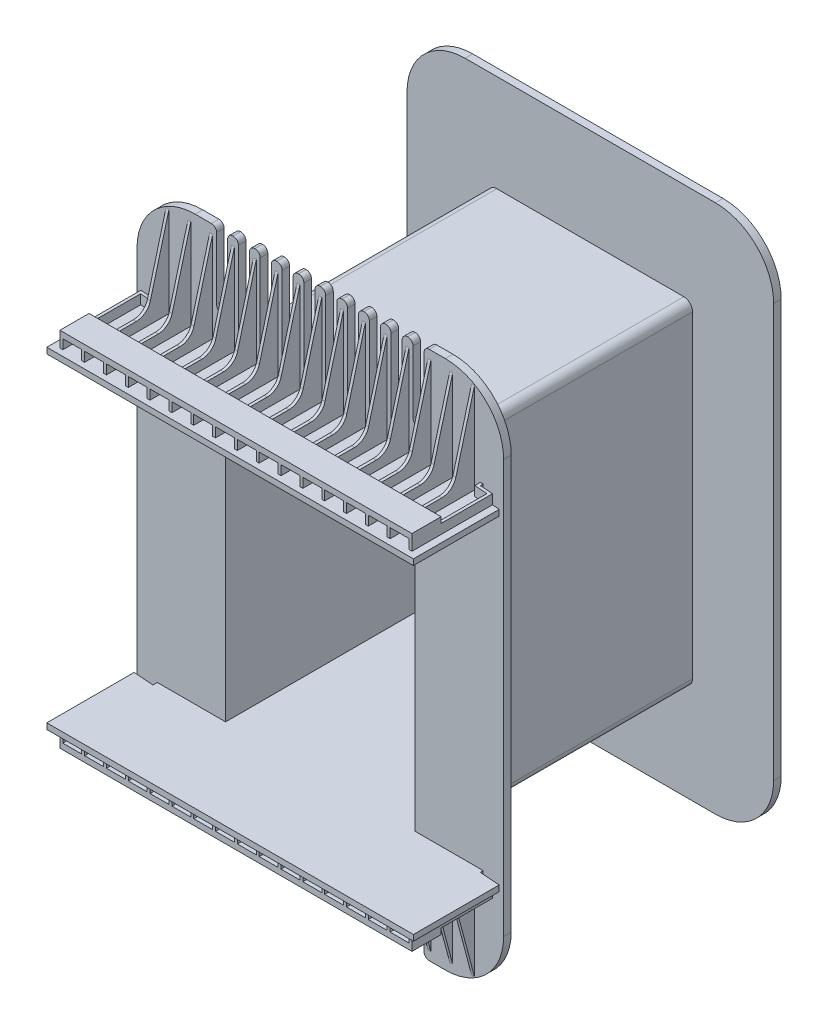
SolidWorks part; units mm, degrees
ref_plane "Vorne" through (0, 0, 0) normal (0, 0, 1) x (1, 0, 0)
ref_plane "Oben" through (0, 0, 0) normal (0, 1, 0) x (1, 0, 0)
ref_plane "Rechts" through (0, 0, 0) normal (1, 0, 0) x (0, 0, -1)
sketch "Skizze1" plane through (0, 0, 0) normal (0, 0, 1) x (1, 0, 0)
  line L1 (0, 0) -> (126, 0)
  line L2 (0, 0) -> (0, 182)
  line L3 (0, 182) -> (126, 182)
  line L4 (126, 0) -> (126, 182)
  dimension "D1" = 126
  dimension "D2" = 182
extrude "Linear austragen1" add sketch "Skizze1" along normal blind 2.6
sketch "Skizze2" plane through (0, 0, 0) normal (0, 0, -1) x (-1, 0, 0)
  line L0 (-63, 182) -> (-63, 0) construction
  line L1 (-126, 182) -> (0, 182) construction
  line L2 (0, 0) -> (-126, 0) construction
  line L4 (-119, 149.9) -> (-7, 149.9)
  line L5 (-119, 149.9) -> (-119, 146)
  line L6 (-119, 146) -> (-7, 146)
  line L7 (-7, 149.9) -> (-7, 146)
  line L8 (-119, 36) -> (-7, 36)
  line L9 (-119, 36) -> (-119, 32.1)
  line L10 (-119, 32.1) -> (-7, 32.1)
  line L11 (-7, 36) -> (-7, 32.1)
  dimension "D1" = 36
  dimension "D2" = 36
  dimension "D3" = 3.9
  dimension "D4" = 3.9
  dimension "D5" = 112
  dimension "D6" = 112
extrude "Linear austragen2" add sketch "Skizze2" along normal blind 2.9
sketch "Skizze3" plane through (0, 0, -2.9) normal (0, 0, -1) x (-1, 0, 0)
  line L0 (-7, 149.9) -> (-119, 149.9) construction
  line L1 (-102, 149.9) -> (-24, 149.9)
  line L2 (-102, 149.9) -> (-102, 146)
  line L3 (-102, 146) -> (-24, 146)
  line L4 (-24, 149.9) -> (-24, 146)
  line L5 (-119, 146) -> (-7, 146) construction
  line L6 (-7, 36) -> (-119, 36) construction
  line L7 (-102, 36) -> (-24, 36)
  line L8 (-102, 36) -> (-102, 32.1)
  line L9 (-102, 32.1) -> (-24, 32.1)
  line L10 (-24, 36) -> (-24, 32.1)
  line L11 (-119, 32.1) -> (-7, 32.1) construction
  line L12 (-63, 182) -> (-63, 0) construction
  line L13 (-126, 182) -> (0, 182) construction
  line L14 (0, 0) -> (-126, 0) construction
  dimension "D1" = 78
  dimension "D2" = 78
extrude "Linear austragen3" add sketch "Skizze3" along normal blind 3.1
sketch "Skizze4" plane through (0, 149.9, 0) normal (0, 1, 0) x (-1, 0, 0)
  line L0 (-63, -6) -> (-63, 0) construction
  line L1 (-24, -6) -> (-102, -6) construction
  line L2 (-126, 0) -> (0, 0) construction
  line L3 (-7, -2.9) -> (-24, -2.9) construction
  line L4 (-55.6, 0) -> (-52.45, 0)
  line L5 (-55.6, 0) -> (-55.6, -6)
  line L6 (-55.6, -6) -> (-52.45, -6)
  line L7 (-52.45, 0) -> (-52.45, -6)
  line L8 (-37.65, 0) -> (-34.5, 0)
  line L9 (-37.65, 0) -> (-37.65, -6)
  line L10 (-37.65, -6) -> (-34.5, -6)
  line L11 (-34.5, 0) -> (-34.5, -6)
  line L12 (-73.55, 0) -> (-70.4, 0)
  line L13 (-73.55, 0) -> (-73.55, -6)
  line L14 (-73.55, -6) -> (-70.4, -6)
  line L15 (-70.4, 0) -> (-70.4, -6)
  line L16 (-91.5, 0) -> (-88.35, 0)
  line L17 (-91.5, 0) -> (-91.5, -6)
  line L18 (-91.5, -6) -> (-88.35, -6)
  line L19 (-88.35, 0) -> (-88.35, -6)
  line L20 (-19.7, 0) -> (-16.55, 0)
  line L21 (-19.7, 0) -> (-19.7, -2.9)
  line L22 (-19.7, -2.9) -> (-16.55, -2.9)
  line L23 (-16.55, 0) -> (-16.55, -2.9)
  line L24 (-102, -2.9) -> (-119, -2.9) construction
  line L25 (-109.45, 0) -> (-106.3, 0)
  line L26 (-109.45, 0) -> (-109.45, -2.9)
  line L27 (-109.45, -2.9) -> (-106.3, -2.9)
  line L28 (-106.3, 0) -> (-106.3, -2.9)
  dimension "D1" = 3.15
  dimension "D2" = 14.8
  dimension "D3" = 14.8
  dimension "D4" = 14.8
extrude "Linear austragen4" add sketch "Skizze4" along normal offset from surface (27.8 mm away) 4.3
sketch "Skizze5" plane through (0, 32.1, 0) normal (0, -1, 0) x (1, 0, 0)
  line L0 (0, 0) -> (126, 0) construction
  line L1 (52.1, 0) -> (55.6, 0)
  line L2 (52.1, 0) -> (52.1, -6)
  line L3 (52.1, -6) -> (55.6, -6)
  line L4 (55.6, 0) -> (55.6, -6)
  line L5 (102, -6) -> (24, -6) construction
  line L6 (63, 0) -> (63, -6) construction
  line L7 (70.4, 0) -> (73.9, 0)
  line L8 (70.4, 0) -> (70.4, -6)
  line L9 (70.4, -6) -> (73.9, -6)
  line L10 (73.9, 0) -> (73.9, -6)
  line L11 (88.7, 0) -> (92.2, 0)
  line L12 (88.7, 0) -> (88.7, -6)
  line L13 (88.7, -6) -> (92.2, -6)
  line L14 (92.2, 0) -> (92.2, -6)
  line L15 (33.8, 0) -> (37.3, 0)
  line L16 (33.8, 0) -> (33.8, -6)
  line L17 (33.8, -6) -> (37.3, -6)
  line L18 (37.3, 0) -> (37.3, -6)
  line L19 (119, -2.9) -> (102, -2.9) construction
  line L20 (107, 0) -> (110.5, 0)
  line L21 (107, 0) -> (107, -2.9)
  line L22 (107, -2.9) -> (110.5, -2.9)
  line L23 (110.5, 0) -> (110.5, -2.9)
  line L24 (24, -2.9) -> (7, -2.9) construction
  line L25 (15.5, 0) -> (19, 0)
  line L26 (15.5, 0) -> (15.5, -2.9)
  line L27 (15.5, -2.9) -> (19, -2.9)
  line L28 (19, 0) -> (19, -2.9)
  dimension "D1" = 14.8
  dimension "D2" = 14.8
  dimension "D3" = 3.5
  dimension "D4" = 14.8
extrude "Linear austragen5" add sketch "Skizze5" along normal offset from surface (27.8 mm away) 4.3
sketch "Skizze6" plane through (33.8, 0, 0) normal (-1, 0, 0) x (0, 0, 1)
  line L0 (-6, 32.1) -> (0, 4.3)
  line L1 (0, 4.3) -> (-6, 4.3)
  line L2 (-6, 4.3) -> (-6, 32.1)
extrude "Schnitt-Linear austragen1" cut sketch "Skizze6" against normal up to surface (58.4 mm away)
sketch "Skizze7" plane through (15.5, 0, 0) normal (-1, 0, 0) x (0, 0, 1)
  line L0 (-2.9, 32.1) -> (0, 4.3)
  line L1 (0, 4.3) -> (-2.9, 4.3)
  line L2 (-2.9, 4.3) -> (-2.9, 32.1)
extrude "Schnitt-Linear austragen2" cut sketch "Skizze7" against normal up to next
sketch "Skizze8" plane through (110.5, 0, 0) normal (1, 0, 0) x (0, 0, -1)
  line L0 (0, 4.3) -> (2.9, 32.1)
  line L1 (2.9, 32.1) -> (2.9, 4.3)
  line L2 (0, 4.3) -> (2.9, 4.3)
extrude "Schnitt-Linear austragen3" cut sketch "Skizze8" against normal up to next
sketch "Skizze9" plane through (109.45, 0, 0) normal (1, 0, 0) x (0, 0, -1)
  line L0 (2.9, 149.9) -> (0, 177.7)
  line L1 (0, 177.7) -> (2.9, 177.7)
  line L2 (2.9, 177.7) -> (2.9, 149.9)
extrude "Schnitt-Linear austragen4" cut sketch "Skizze9" against normal up to next
sketch "Skizze10" plane through (91.5, 0, 0) normal (1, 0, 0) x (0, 0, -1)
  line L0 (0, 177.7) -> (6, 177.7)
  line L1 (6, 177.7) -> (6, 149.9)
  line L2 (6, 149.9) -> (0, 177.7)
extrude "Schnitt-Linear austragen5" cut sketch "Skizze10" against normal up to surface (57 mm away)
sketch "Skizze11" plane through (16.55, 0, 0) normal (-1, 0, 0) x (0, 0, 1)
  line L0 (-2.9, 149.9) -> (-2.9, 177.7)
  line L1 (-2.9, 177.7) -> (0, 177.7)
  line L2 (0, 177.7) -> (-2.9, 149.9)
extrude "Schnitt-Linear austragen6" cut sketch "Skizze11" against normal up to next
sketch "Skizze12" plane through (0, 0, 2.6) normal (0, 0, 1) x (1, 0, 0)
  line L0 (63, 182) -> (63, 0) construction
  line L1 (126, 182) -> (0, 182) construction
  line L2 (0, 0) -> (126, 0) construction
  line L4 (27.85, 148.6) -> (98.15, 148.6)
  line L5 (27.85, 148.6) -> (27.85, 33.4)
  line L6 (27.85, 33.4) -> (98.15, 33.4)
  line L7 (98.15, 148.6) -> (98.15, 33.4)
  dimension "D1" = 33.4
  dimension "D2" = 33.4
  dimension "D3" = 70.3
extrude "Linear austragen6" add sketch "Skizze12" along normal blind 90.2
sketch "Skizze13" plane through (0, 0, 92.8) normal (0, 0, 1) x (1, 0, 0)
  line L0 (0, 0) -> (126, 0) construction
  line L1 (0, 182) -> (126, 182)
  line L2 (0, 182) -> (0, 0)
  line L3 (0, 0) -> (126, 0)
  line L4 (126, 182) -> (126, 0)
  line L5 (126, 182) -> (0, 182) construction
  line L8 (0, 182) -> (0, 0) construction
  line L9 (126, 0) -> (126, 182) construction
extrude "Linear austragen7" add sketch "Skizze13" along normal blind 2.6
sketch "Skizze14" plane through (0, 0, 95.4) normal (0, 0, 1) x (1, 0, 0)
  line L0 (63, 182) -> (63, 0) construction
  line L1 (126, 182) -> (0, 182) construction
  line L2 (0, 0) -> (126, 0) construction
  line L3 (126, 91) -> (0, 91) construction
  line L4 (126, 0) -> (126, 182) construction
  line L5 (0, 182) -> (0, 0) construction
  line L7 (30.45, 145.9) -> (95.55, 145.9)
  line L8 (30.45, 145.9) -> (30.45, 36.1)
  line L9 (30.45, 36.1) -> (95.55, 36.1)
  line L10 (95.55, 145.9) -> (95.55, 36.1)
  dimension "D1" = 36.1
  dimension "D2" = 36.1
  dimension "D3" = 65.1
extrude "Schnitt-Linear austragen7" cut sketch "Skizze14" against normal through all
sketch "Skizze15" plane through (0, 0, 95.4) normal (0, 0, 1) x (1, 0, 0)
  line L0 (30.45, 36.1) -> (95.55, 36.1) construction
  line L1 (0, 147.9) -> (126, 147.9)
  line L2 (0, 147.9) -> (0, 145.9)
  line L3 (0, 145.9) -> (126, 145.9)
  line L4 (126, 147.9) -> (126, 145.9)
  line L5 (0, 36.1) -> (126, 36.1)
  line L6 (0, 36.1) -> (0, 34.1)
  line L7 (0, 34.1) -> (126, 34.1)
  line L8 (126, 36.1) -> (126, 34.1)
  line L9 (95.55, 145.9) -> (30.45, 145.9) construction
  line L10 (126, 0) -> (126, 182) construction
  line L11 (0, 182) -> (0, 0) construction
  dimension "D1" = 2
  dimension "D2" = 2
extrude "Linear austragen8" add sketch "Skizze15" along normal blind 31
sketch "Skizze16" plane through (0, 147.9, 0) normal (0, 1, 0) x (-1, 0, 0)
  line L0 (-126, 126.4) -> (0, 126.4) construction
  line L3 (-3.5, 124.4) -> (-2.5, 124.4)
  line L4 (-3.5, 124.4) -> (-3.5, 95.4)
  line L5 (-3.5, 95.4) -> (-2.5, 95.4)
  line L6 (-2.5, 124.4) -> (-2.5, 95.4)
  line L7 (-126, 95.4) -> (0, 95.4) construction
  line L8 (-63, 126.4) -> (-63, 95.4) construction
  line L9 (-11, 124.4) -> (-11, 95.4)
  line L10 (-10, 124.4) -> (-10, 95.4)
  line L11 (-11, 124.4) -> (-10, 124.4)
  line L12 (-11, 95.4) -> (-10, 95.4)
  line L13 (-18.5, 124.4) -> (-18.5, 95.4)
  line L14 (-17.5, 124.4) -> (-17.5, 95.4)
  line L15 (-18.5, 124.4) -> (-17.5, 124.4)
  line L16 (-18.5, 95.4) -> (-17.5, 95.4)
  line L17 (-26, 124.4) -> (-26, 95.4)
  line L18 (-25, 124.4) -> (-25, 95.4)
  line L19 (-26, 124.4) -> (-25, 124.4)
  line L20 (-26, 95.4) -> (-25, 95.4)
  line L21 (-33.5, 124.4) -> (-33.5, 95.4)
  line L22 (-32.5, 124.4) -> (-32.5, 95.4)
  line L23 (-33.5, 124.4) -> (-32.5, 124.4)
  line L24 (-33.5, 95.4) -> (-32.5, 95.4)
  line L25 (-41, 124.4) -> (-41, 95.4)
  line L26 (-40, 124.4) -> (-40, 95.4)
  line L27 (-41, 124.4) -> (-40, 124.4)
  line L28 (-41, 95.4) -> (-40, 95.4)
  line L29 (-48.5, 124.4) -> (-48.5, 95.4)
  line L30 (-47.5, 124.4) -> (-47.5, 95.4)
  line L31 (-48.5, 124.4) -> (-47.5, 124.4)
  line L32 (-48.5, 95.4) -> (-47.5, 95.4)
  line L33 (-56, 124.4) -> (-56, 95.4)
  line L34 (-55, 124.4) -> (-55, 95.4)
  line L35 (-56, 124.4) -> (-55, 124.4)
  line L36 (-56, 95.4) -> (-55, 95.4)
  line L37 (-63.5, 124.4) -> (-63.5, 95.4)
  line L38 (-62.5, 124.4) -> (-62.5, 95.4)
  line L39 (-63.5, 124.4) -> (-62.5, 124.4)
  line L40 (-63.5, 95.4) -> (-62.5, 95.4)
  line L41 (-71, 124.4) -> (-71, 95.4)
  line L42 (-70, 124.4) -> (-70, 95.4)
  line L43 (-71, 124.4) -> (-70, 124.4)
  line L44 (-71, 95.4) -> (-70, 95.4)
  line L45 (-78.5, 124.4) -> (-78.5, 95.4)
  line L46 (-77.5, 124.4) -> (-77.5, 95.4)
  line L47 (-78.5, 124.4) -> (-77.5, 124.4)
  line L48 (-78.5, 95.4) -> (-77.5, 95.4)
  line L49 (-86, 124.4) -> (-86, 95.4)
  line L50 (-85, 124.4) -> (-85, 95.4)
  line L51 (-86, 124.4) -> (-85, 124.4)
  line L52 (-86, 95.4) -> (-85, 95.4)
  line L53 (-93.5, 124.4) -> (-93.5, 95.4)
  line L54 (-92.5, 124.4) -> (-92.5, 95.4)
  line L55 (-93.5, 124.4) -> (-92.5, 124.4)
  line L56 (-93.5, 95.4) -> (-92.5, 95.4)
  line L57 (-101, 124.4) -> (-101, 95.4)
  line L58 (-100, 124.4) -> (-100, 95.4)
  line L59 (-101, 124.4) -> (-100, 124.4)
  line L60 (-101, 95.4) -> (-100, 95.4)
  line L61 (-108.5, 124.4) -> (-108.5, 95.4)
  line L62 (-107.5, 124.4) -> (-107.5, 95.4)
  line L63 (-108.5, 124.4) -> (-107.5, 124.4)
  line L64 (-108.5, 95.4) -> (-107.5, 95.4)
  line L65 (-116, 124.4) -> (-116, 95.4)
  line L66 (-115, 124.4) -> (-115, 95.4)
  line L67 (-116, 124.4) -> (-115, 124.4)
  line L68 (-116, 95.4) -> (-115, 95.4)
  line L69 (-123.5, 124.4) -> (-123.5, 95.4)
  line L70 (-122.5, 124.4) -> (-122.5, 95.4)
  line L71 (-123.5, 124.4) -> (-122.5, 124.4)
  line L72 (-123.5, 95.4) -> (-122.5, 95.4)
  dimension "D1" = 1
  dimension "D2" = 60.5
  dimension "D3" = 60.5
  dimension "D4" = 6.5
  dimension "D5" = 6.5
  dimension "D6" = 6.5
  dimension "D7" = 6.5
  dimension "D8" = 6.5
  dimension "D9" = 6.5
  dimension "D10" = 6.5
  dimension "D11" = 6.5
  dimension "D12" = 2
extrude "Linear austragen9" add sketch "Skizze16" along normal blind 3.3
sketch "Skizze18" plane through (0, 34.1, 0) normal (0, -1, 0) x (1, 0, 0)
  line L0 (63, 95.4) -> (63, 126.4) construction
  line L1 (0, 95.4) -> (126, 95.4) construction
  line L2 (0, 126.4) -> (126, 126.4) construction
  line L3 (116, 95.4) -> (116, 124.4)
  line L4 (123.5, 95.4) -> (122.5, 95.4)
  line L5 (123.5, 95.4) -> (123.5, 124.4)
  line L6 (123.5, 124.4) -> (122.5, 124.4)
  line L7 (122.5, 95.4) -> (122.5, 124.4)
  line L8 (116, 95.4) -> (115, 95.4)
  line L9 (116, 124.4) -> (115, 124.4)
  line L10 (115, 95.4) -> (115, 124.4)
  line L11 (108.5, 95.4) -> (108.5, 124.4)
  line L12 (108.5, 95.4) -> (107.5, 95.4)
  line L13 (108.5, 124.4) -> (107.5, 124.4)
  line L14 (107.5, 95.4) -> (107.5, 124.4)
  line L15 (101, 95.4) -> (101, 124.4)
  line L16 (101, 95.4) -> (100, 95.4)
  line L17 (101, 124.4) -> (100, 124.4)
  line L18 (100, 95.4) -> (100, 124.4)
  line L19 (93.5, 95.4) -> (93.5, 124.4)
  line L20 (93.5, 95.4) -> (92.5, 95.4)
  line L21 (93.5, 124.4) -> (92.5, 124.4)
  line L22 (92.5, 95.4) -> (92.5, 124.4)
  line L23 (86, 95.4) -> (86, 124.4)
  line L24 (86, 95.4) -> (85, 95.4)
  line L25 (86, 124.4) -> (85, 124.4)
  line L26 (85, 95.4) -> (85, 124.4)
  line L27 (78.5, 95.4) -> (78.5, 124.4)
  line L28 (78.5, 95.4) -> (77.5, 95.4)
  line L29 (78.5, 124.4) -> (77.5, 124.4)
  line L30 (77.5, 95.4) -> (77.5, 124.4)
  line L31 (71, 95.4) -> (71, 124.4)
  line L32 (71, 95.4) -> (70, 95.4)
  line L33 (71, 124.4) -> (70, 124.4)
  line L34 (70, 95.4) -> (70, 124.4)
  line L35 (63.5, 95.4) -> (63.5, 124.4)
  line L36 (63.5, 95.4) -> (62.5, 95.4)
  line L37 (63.5, 124.4) -> (62.5, 124.4)
  line L38 (62.5, 95.4) -> (62.5, 124.4)
  line L39 (56, 95.4) -> (56, 124.4)
  line L40 (56, 95.4) -> (55, 95.4)
  line L41 (56, 124.4) -> (55, 124.4)
  line L42 (55, 95.4) -> (55, 124.4)
  line L43 (48.5, 95.4) -> (48.5, 124.4)
  line L44 (48.5, 95.4) -> (47.5, 95.4)
  line L45 (48.5, 124.4) -> (47.5, 124.4)
  line L46 (47.5, 95.4) -> (47.5, 124.4)
  line L47 (41, 95.4) -> (41, 124.4)
  line L48 (41, 95.4) -> (40, 95.4)
  line L49 (41, 124.4) -> (40, 124.4)
  line L50 (40, 95.4) -> (40, 124.4)
  line L51 (33.5, 95.4) -> (33.5, 124.4)
  line L52 (33.5, 95.4) -> (32.5, 95.4)
  line L53 (33.5, 124.4) -> (32.5, 124.4)
  line L54 (32.5, 95.4) -> (32.5, 124.4)
  line L55 (26, 95.4) -> (26, 124.4)
  line L56 (26, 95.4) -> (25, 95.4)
  line L57 (26, 124.4) -> (25, 124.4)
  line L58 (25, 95.4) -> (25, 124.4)
  line L59 (18.5, 95.4) -> (18.5, 124.4)
  line L60 (18.5, 95.4) -> (17.5, 95.4)
  line L61 (18.5, 124.4) -> (17.5, 124.4)
  line L62 (17.5, 95.4) -> (17.5, 124.4)
  line L63 (11, 95.4) -> (11, 124.4)
  line L64 (11, 95.4) -> (10, 95.4)
  line L65 (11, 124.4) -> (10, 124.4)
  line L66 (10, 95.4) -> (10, 124.4)
  line L67 (3.5, 95.4) -> (3.5, 124.4)
  line L68 (3.5, 95.4) -> (2.5, 95.4)
  line L69 (3.5, 124.4) -> (2.5, 124.4)
  line L70 (2.5, 95.4) -> (2.5, 124.4)
  dimension "D1" = 2
  dimension "D2" = 1
  dimension "D3" = 60.5
  dimension "D4" = 6.5
  dimension "D5" = 6.5
  dimension "D6" = 6.5
  dimension "D7" = 6.5
  dimension "D8" = 6.5
  dimension "D9" = 6.5
  dimension "D10" = 6.5
  dimension "D11" = 6.5
  dimension "D12" = 6.5
  dimension "D13" = 6.5
  dimension "D14" = 6.5
  dimension "D15" = 6.5
  dimension "D16" = 6.5
  dimension "D17" = 6.5
  dimension "D18" = 6.5
  dimension "D19" = 6.5
extrude "Linear austragen10" add sketch "Skizze18" along normal blind 3.3
sketch "Skizze19" plane through (0, 30.8, 0) normal (0, -1, 0) x (1, 0, 0)
  line L0 (123.5, 95.4) -> (123.5, 124.4) construction
  line L1 (2.5, 124.4) -> (123.5, 124.4)
  line L2 (2.5, 124.4) -> (2.5, 114.4)
  line L3 (2.5, 114.4) -> (123.5, 114.4)
  line L4 (123.5, 124.4) -> (123.5, 114.4)
  dimension "D1" = 10
extrude "Linear austragen11" add sketch "Skizze19" along normal blind 2
sketch "Skizze20" plane through (0, 151.2, 0) normal (0, 1, 0) x (-1, 0, 0)
  line L0 (-2.5, 95.4) -> (-2.5, 124.4) construction
  line L1 (-123.5, 124.4) -> (-2.5, 124.4)
  line L2 (-123.5, 124.4) -> (-123.5, 114.4)
  line L3 (-123.5, 114.4) -> (-2.5, 114.4)
  line L4 (-2.5, 124.4) -> (-2.5, 114.4)
  dimension "D1" = 10
extrude "Linear austragen12" add sketch "Skizze20" along normal blind 2
sketch "Skizze21" plane through (0, 151.2, 0) normal (0, 1, 0) x (-1, 0, 0)
  line L0 (-115, 95.4) -> (-115, 114.4) construction
  line L1 (-116, 95.4) -> (-115, 95.4)
  line L2 (-116, 95.4) -> (-116, 102.8)
  line L3 (-116, 102.8) -> (-115, 102.8)
  line L4 (-115, 95.4) -> (-115, 102.8)
  line L5 (-107.5, 95.4) -> (-107.5, 114.4) construction
  line L6 (-108.5, 95.4) -> (-107.5, 95.4)
  line L7 (-108.5, 95.4) -> (-108.5, 102.8)
  line L8 (-108.5, 102.8) -> (-107.5, 102.8)
  line L9 (-107.5, 95.4) -> (-107.5, 102.8)
  line L10 (-100, 95.4) -> (-100, 114.4) construction
  line L11 (-101, 95.4) -> (-100, 95.4)
  line L12 (-101, 95.4) -> (-101, 102.8)
  line L13 (-101, 102.8) -> (-100, 102.8)
  line L14 (-100, 95.4) -> (-100, 102.8)
  line L15 (-92.5, 95.4) -> (-92.5, 114.4) construction
  line L16 (-93.5, 95.4) -> (-92.5, 95.4)
  line L17 (-93.5, 95.4) -> (-93.5, 102.8)
  line L18 (-93.5, 102.8) -> (-92.5, 102.8)
  line L19 (-92.5, 95.4) -> (-92.5, 102.8)
  line L20 (-85, 95.4) -> (-85, 114.4) construction
  line L21 (-86, 95.4) -> (-85, 95.4)
  line L22 (-86, 95.4) -> (-86, 102.8)
  line L23 (-86, 102.8) -> (-85, 102.8)
  line L24 (-85, 95.4) -> (-85, 102.8)
  line L25 (-77.5, 95.4) -> (-77.5, 114.4) construction
  line L26 (-78.5, 95.4) -> (-77.5, 95.4)
  line L27 (-78.5, 95.4) -> (-78.5, 102.8)
  line L28 (-78.5, 102.8) -> (-77.5, 102.8)
  line L29 (-77.5, 95.4) -> (-77.5, 102.8)
  line L30 (-70, 95.4) -> (-70, 114.4) construction
  line L31 (-71, 95.4) -> (-70, 95.4)
  line L32 (-71, 95.4) -> (-71, 102.8)
  line L33 (-71, 102.8) -> (-70, 102.8)
  line L34 (-70, 95.4) -> (-70, 102.8)
  line L35 (-62.5, 95.4) -> (-62.5, 114.4) construction
  line L36 (-63.5, 95.4) -> (-62.5, 95.4)
  line L37 (-63.5, 95.4) -> (-63.5, 102.8)
  line L38 (-63.5, 102.8) -> (-62.5, 102.8)
  line L39 (-62.5, 95.4) -> (-62.5, 102.8)
  line L40 (-55, 95.4) -> (-55, 114.4) construction
  line L41 (-56, 95.4) -> (-55, 95.4)
  line L42 (-56, 95.4) -> (-56, 102.8)
  line L43 (-56, 102.8) -> (-55, 102.8)
  line L44 (-55, 95.4) -> (-55, 102.8)
  line L45 (-47.5, 95.4) -> (-47.5, 114.4) construction
  line L46 (-48.5, 95.4) -> (-47.5, 95.4)
  line L47 (-48.5, 95.4) -> (-48.5, 102.8)
  line L48 (-48.5, 102.8) -> (-47.5, 102.8)
  line L49 (-47.5, 95.4) -> (-47.5, 102.8)
  line L50 (-40, 95.4) -> (-40, 114.4) construction
  line L51 (-41, 95.4) -> (-40, 95.4)
  line L52 (-41, 95.4) -> (-41, 102.8)
  line L53 (-41, 102.8) -> (-40, 102.8)
  line L54 (-40, 95.4) -> (-40, 102.8)
  line L55 (-32.5, 95.4) -> (-32.5, 114.4) construction
  line L56 (-33.5, 95.4) -> (-32.5, 95.4)
  line L57 (-33.5, 95.4) -> (-33.5, 102.8)
  line L58 (-33.5, 102.8) -> (-32.5, 102.8)
  line L59 (-32.5, 95.4) -> (-32.5, 102.8)
  line L60 (-25, 95.4) -> (-25, 114.4) construction
  line L61 (-26, 95.4) -> (-25, 95.4)
  line L62 (-26, 95.4) -> (-26, 102.8)
  line L63 (-26, 102.8) -> (-25, 102.8)
  line L64 (-25, 95.4) -> (-25, 102.8)
  line L65 (-17.5, 95.4) -> (-17.5, 114.4) construction
  line L66 (-18.5, 95.4) -> (-17.5, 95.4)
  line L67 (-18.5, 95.4) -> (-18.5, 102.8)
  line L68 (-18.5, 102.8) -> (-17.5, 102.8)
  line L69 (-17.5, 95.4) -> (-17.5, 102.8)
  line L70 (-10, 95.4) -> (-10, 114.4) construction
  line L71 (-11, 95.4) -> (-10, 95.4)
  line L72 (-11, 95.4) -> (-11, 102.8)
  line L73 (-11, 102.8) -> (-10, 102.8)
  line L74 (-10, 95.4) -> (-10, 102.8)
  line L75 (-126, 92.8) -> (0, 92.8) construction
  dimension "D1" = 10
extrude "Linear austragen13" add sketch "Skizze21" along normal offset from surface (27.8 mm away) 3
sketch "Skizze22" plane through (10, 0, 0) normal (-1, 0, 0) x (0, 0, 1)
  line L0 (102.8, 151.2) -> (95.4, 179)
  line L1 (95.4, 179) -> (102.8, 179)
  line L2 (102.8, 179) -> (102.8, 151.2)
extrude "Schnitt-Linear austragen8" cut sketch "Skizze22" against normal through all
sketch "Skizze23" plane through (0, 30.8, 0) normal (0, -1, 0) x (1, 0, 0)
  line L0 (10, 114.4) -> (10, 95.4) construction
  line L1 (11, 95.4) -> (10, 95.4)
  line L2 (11, 95.4) -> (11, 102.8)
  line L3 (11, 102.8) -> (10, 102.8)
  line L4 (10, 95.4) -> (10, 102.8)
  line L5 (17.5, 114.4) -> (17.5, 95.4) construction
  line L6 (18.5, 95.4) -> (17.5, 95.4)
  line L7 (18.5, 95.4) -> (18.5, 102.8)
  line L8 (18.5, 102.8) -> (17.5, 102.8)
  line L9 (17.5, 95.4) -> (17.5, 102.8)
  line L10 (25, 114.4) -> (25, 95.4) construction
  line L11 (26, 95.4) -> (25, 95.4)
  line L12 (26, 95.4) -> (26, 102.8)
  line L13 (26, 102.8) -> (25, 102.8)
  line L14 (25, 95.4) -> (25, 102.8)
  line L15 (32.5, 114.4) -> (32.5, 95.4) construction
  line L16 (33.5, 95.4) -> (32.5, 95.4)
  line L17 (33.5, 95.4) -> (33.5, 102.8)
  line L18 (33.5, 102.8) -> (32.5, 102.8)
  line L19 (32.5, 95.4) -> (32.5, 102.8)
  line L20 (40, 114.4) -> (40, 95.4) construction
  line L21 (41, 95.4) -> (40, 95.4)
  line L22 (41, 95.4) -> (41, 102.8)
  line L23 (41, 102.8) -> (40, 102.8)
  line L24 (40, 95.4) -> (40, 102.8)
  line L25 (47.5, 114.4) -> (47.5, 95.4) construction
  line L26 (48.5, 95.4) -> (47.5, 95.4)
  line L27 (48.5, 95.4) -> (48.5, 102.8)
  line L28 (48.5, 102.8) -> (47.5, 102.8)
  line L29 (47.5, 95.4) -> (47.5, 102.8)
  line L30 (55, 114.4) -> (55, 95.4) construction
  line L31 (56, 95.4) -> (55, 95.4)
  line L32 (56, 95.4) -> (56, 102.8)
  line L33 (56, 102.8) -> (55, 102.8)
  line L34 (55, 95.4) -> (55, 102.8)
  line L35 (62.5, 114.4) -> (62.5, 95.4) construction
  line L36 (63.5, 95.4) -> (62.5, 95.4)
  line L37 (63.5, 95.4) -> (63.5, 102.8)
  line L38 (63.5, 102.8) -> (62.5, 102.8)
  line L39 (62.5, 95.4) -> (62.5, 102.8)
  line L40 (70, 114.4) -> (70, 95.4) construction
  line L41 (71, 95.4) -> (70, 95.4)
  line L42 (71, 95.4) -> (71, 102.8)
  line L43 (71, 102.8) -> (70, 102.8)
  line L44 (70, 95.4) -> (70, 102.8)
  line L45 (77.5, 114.4) -> (77.5, 95.4) construction
  line L46 (78.5, 95.4) -> (77.5, 95.4)
  line L47 (78.5, 95.4) -> (78.5, 102.8)
  line L48 (78.5, 102.8) -> (77.5, 102.8)
  line L49 (77.5, 95.4) -> (77.5, 102.8)
  line L50 (85, 114.4) -> (85, 95.4) construction
  line L51 (86, 95.4) -> (85, 95.4)
  line L52 (86, 95.4) -> (86, 102.8)
  line L53 (86, 102.8) -> (85, 102.8)
  line L54 (85, 95.4) -> (85, 102.8)
  line L55 (92.5, 114.4) -> (92.5, 95.4) construction
  line L56 (93.5, 95.4) -> (92.5, 95.4)
  line L57 (93.5, 95.4) -> (93.5, 102.8)
  line L58 (93.5, 102.8) -> (92.5, 102.8)
  line L59 (92.5, 95.4) -> (92.5, 102.8)
  line L60 (100, 114.4) -> (100, 95.4) construction
  line L61 (101, 95.4) -> (100, 95.4)
  line L62 (101, 95.4) -> (101, 102.8)
  line L63 (101, 102.8) -> (100, 102.8)
  line L64 (100, 95.4) -> (100, 102.8)
  line L65 (107.5, 114.4) -> (107.5, 95.4) construction
  line L66 (108.5, 95.4) -> (107.5, 95.4)
  line L67 (108.5, 95.4) -> (108.5, 102.8)
  line L68 (108.5, 102.8) -> (107.5, 102.8)
  line L69 (107.5, 95.4) -> (107.5, 102.8)
  line L70 (115, 114.4) -> (115, 95.4) construction
  line L71 (116, 95.4) -> (115, 95.4)
  line L72 (116, 95.4) -> (116, 102.8)
  line L73 (116, 102.8) -> (115, 102.8)
  line L74 (115, 95.4) -> (115, 102.8)
  line L75 (0, 92.8) -> (126, 92.8) construction
  dimension "D1" = 10
extrude "Linear austragen14" add sketch "Skizze23" along normal offset from surface (27.8 mm away) 3
sketch "Skizze24" plane through (10, 0, 0) normal (-1, 0, 0) x (0, 0, 1)
  line L0 (102.8, 30.8) -> (95.4, 3)
  line L1 (95.4, 3) -> (102.8, 3)
  line L2 (102.8, 3) -> (102.8, 30.8)
extrude "Schnitt-Linear austragen9" cut sketch "Skizze24" against normal through all
sketch "Skizze25" plane through (0, 0, 95.4) normal (0, 0, 1) x (1, 0, 0)
  line L0 (63, 182) -> (63, 145.9) construction
  line L1 (126, 182) -> (0, 182) construction
  line L2 (0, 145.9) -> (126, 145.9) construction
  line L4 (57.35, 182) -> (61.15, 182)
  line L5 (57.35, 182) -> (57.35, 151)
  line L6 (57.35, 151) -> (61.15, 151)
  line L7 (61.15, 182) -> (61.15, 151)
  line L8 (64.85, 182) -> (68.65, 182)
  line L9 (64.85, 182) -> (64.85, 151)
  line L10 (64.85, 151) -> (68.65, 151)
  line L11 (68.65, 182) -> (68.65, 151)
  line L12 (72.35, 182) -> (76.15, 182)
  line L13 (72.35, 182) -> (72.35, 151)
  line L14 (72.35, 151) -> (76.15, 151)
  line L15 (76.15, 182) -> (76.15, 151)
  line L16 (79.85, 182) -> (83.65, 182)
  line L17 (79.85, 182) -> (79.85, 151)
  line L18 (79.85, 151) -> (83.65, 151)
  line L19 (83.65, 182) -> (83.65, 151)
  line L20 (87.35, 182) -> (91.15, 182)
  line L21 (87.35, 182) -> (87.35, 148.6)
  line L22 (87.35, 148.6) -> (91.15, 148.6)
  line L23 (91.15, 182) -> (91.15, 148.6)
  line L24 (94.85, 182) -> (98.65, 182)
  line L25 (94.85, 182) -> (94.85, 157)
  line L26 (94.85, 157) -> (98.65, 157)
  line L27 (98.65, 182) -> (98.65, 157)
  line L30 (98.15, 148.6) -> (27.85, 148.6) construction
  line L36 (49.85, 182) -> (53.65, 182)
  line L37 (49.85, 182) -> (49.85, 151)
  line L38 (49.85, 151) -> (53.65, 151)
  line L39 (53.65, 182) -> (53.65, 151)
  line L40 (42.35, 182) -> (46.15, 182)
  line L41 (42.35, 182) -> (42.35, 151)
  line L42 (42.35, 151) -> (46.15, 151)
  line L43 (46.15, 182) -> (46.15, 151)
  line L44 (34.85, 182) -> (38.65, 182)
  line L45 (34.85, 182) -> (34.85, 148.6)
  line L46 (34.85, 148.6) -> (38.65, 148.6)
  line L47 (38.65, 182) -> (38.65, 148.6)
  line L48 (27.35, 182) -> (31.15, 182)
  line L49 (27.35, 182) -> (27.35, 157)
  line L50 (27.35, 157) -> (31.15, 157)
  line L51 (31.15, 182) -> (31.15, 157)
  dimension "D2" = 25
  dimension "D3" = 31
  dimension "D4" = 3.7
  dimension "D5" = 3.7
  dimension "D6" = 3.7
  dimension "D7" = 3.7
  dimension "D8" = 3.7
  dimension "D9" = 3.8
  dimension "D10" = 25
extrude "Schnitt-Linear austragen10" cut sketch "Skizze25" against normal up to surface (2.6 mm away)
sketch "Skizze26" plane through (0, 0, 95.4) normal (0, 0, 1) x (1, 0, 0)
  line L0 (0, 0) -> (126, 0) construction
  line L1 (27.35, 0) -> (31.15, 0)
  line L2 (27.35, 0) -> (27.35, 25)
  line L3 (27.35, 25) -> (31.15, 25)
  line L4 (31.15, 0) -> (31.15, 25)
  line L5 (63, 0) -> (63, 145.9) construction
  line L6 (34.85, 0) -> (38.65, 0)
  line L7 (34.85, 0) -> (34.85, 33.4)
  line L8 (34.85, 33.4) -> (38.65, 33.4)
  line L9 (38.65, 0) -> (38.65, 33.4)
  line L10 (42.35, 0) -> (46.15, 0)
  line L11 (42.35, 0) -> (42.35, 31)
  line L12 (42.35, 31) -> (46.15, 31)
  line L13 (46.15, 0) -> (46.15, 31)
  line L14 (49.85, 0) -> (53.65, 0)
  line L15 (49.85, 0) -> (49.85, 31)
  line L16 (49.85, 31) -> (53.65, 31)
  line L17 (53.65, 0) -> (53.65, 31)
  line L18 (57.35, 0) -> (61.15, 0)
  line L19 (57.35, 0) -> (57.35, 31)
  line L20 (57.35, 31) -> (61.15, 31)
  line L21 (61.15, 0) -> (61.15, 31)
  line L22 (64.85, 0) -> (68.65, 0)
  line L23 (64.85, 0) -> (64.85, 31)
  line L24 (64.85, 31) -> (68.65, 31)
  line L25 (68.65, 0) -> (68.65, 31)
  line L26 (72.35, 0) -> (76.15, 0)
  line L27 (72.35, 0) -> (72.35, 31)
  line L28 (72.35, 31) -> (76.15, 31)
  line L29 (76.15, 0) -> (76.15, 31)
  line L30 (79.85, 0) -> (83.65, 0)
  line L31 (79.85, 0) -> (79.85, 31)
  line L32 (79.85, 31) -> (83.65, 31)
  line L33 (83.65, 0) -> (83.65, 31)
  line L34 (87.35, 0) -> (91.15, 0)
  line L35 (87.35, 0) -> (87.35, 33.4)
  line L36 (87.35, 33.4) -> (91.15, 33.4)
  line L37 (91.15, 0) -> (91.15, 33.4)
  line L38 (94.85, 0) -> (98.65, 0)
  line L39 (94.85, 0) -> (94.85, 25)
  line L40 (94.85, 25) -> (98.65, 25)
  line L41 (98.65, 0) -> (98.65, 25)
  line L42 (0, 145.9) -> (126, 145.9) construction
  line L43 (27.85, 33.4) -> (98.15, 33.4) construction
  dimension "D1" = 3.8
  dimension "D2" = 3.7
  dimension "D3" = 3.7
  dimension "D4" = 3.7
  dimension "D5" = 3.7
  dimension "D6" = 3.7
  dimension "D7" = 25
  dimension "D8" = 25
  dimension "D9" = 31
extrude "Schnitt-Linear austragen11" cut sketch "Skizze26" against normal up to surface (2.6 mm away)
fillet "Verrundung1" radius 1.8 92 edges at (119, 147.95, -2.9) (57.35, 151, 94.1) (57.35, 182, 94.1) (61.15, 182, 94.1) (61.15, 151, 94.1) (64.85, 151, 94.1) (64.85, 182, 94.1) (68.65, 182, 94.1) (68.65, 151, 94.1) (7, 147.95, -2.9) (72.35, 151, 94.1) (72.35, 182, 94.1) (76.15, 182, 94.1) (76.15, 151, 94.1) (79.85, 151, 94.1) (79.85, 182, 94.1) (83.65, 182, 94.1) (83.65, 151, 94.1) (87.35, 182, 94.1) (91.15, 182, 94.1) (94.85, 157, 94.1) (94.85, 182, 94.1) (98.65, 182, 94.1) (98.65, 157, 94.1) (49.85, 151, 94.1) (49.85, 182, 94.1) (53.65, 182, 94.1) (53.65, 151, 94.1) (42.35, 151, 94.1) (42.35, 182, 94.1) (46.15, 182, 94.1) (46.15, 151, 94.1) (34.85, 182, 94.1) (38.65, 182, 94.1) (27.35, 157, 94.1) (27.35, 182, 94.1) (31.15, 182, 94.1) (31.15, 157, 94.1) (27.35, 0, 94.1) (27.35, 25, 94.1) (31.15, 25, 94.1) (31.15, 0, 94.1) (34.85, 0, 94.1) (38.65, 0, 94.1) (42.35, 0, 94.1) (42.35, 31, 94.1) (46.15, 31, 94.1) (46.15, 0, 94.1) (49.85, 0, 94.1) (49.85, 31, 94.1) (53.65, 31, 94.1) (53.65, 0, 94.1) (57.35, 0, 94.1) (57.35, 31, 94.1) (61.15, 31, 94.1) (61.15, 0, 94.1) (64.85, 0, 94.1) (64.85, 31, 94.1) (68.65, 31, 94.1) (68.65, 0, 94.1) (72.35, 0, 94.1) (72.35, 31, 94.1) (76.15, 31, 94.1) (76.15, 0, 94.1) (79.85, 0, 94.1) (79.85, 31, 94.1) (83.65, 31, 94.1) (83.65, 0, 94.1) (87.35, 0, 94.1) (91.15, 0, 94.1) (94.85, 0, 94.1) (94.85, 25, 94.1) (98.65, 25, 94.1) (98.65, 0, 94.1) (119, 34.05, -2.9) (7, 34.05, -2.9) (102, 147.95, -6) (24, 147.95, -6) (102, 34.05, -6) (24, 34.05, -6)
fillet "Verrundung2" radius 20 10 edges at (0, 182, 94.1) (0, 0, 94.1) (126, 0, 94.1) (126, 182, 94.1) (0, 182, 1.3) (126, 182, 1.3) (126, 0, 1.3) (0, 0, 1.3)
fillet "Verrundung3" radius 3 4 edges at (27.85, 148.6, 47.7) (27.85, 33.4, 47.7) (98.15, 33.4, 47.7) (98.15, 148.6, 47.7)
sketch "Skizze27" plane through (0, 147.9, 0) normal (0, 1, 0) x (-1, 0, 0)
  line L0 (-126, 95.4) -> (-126, 96.9)
  line L1 (-126, 126.4) -> (-126, 95.4) construction
  line L2 (-126, 96.9) -> (-119, 96.4)
  line L3 (-119, 96.4) -> (-119, 95.4)
  line L4 (-106, 95.4) -> (-126, 95.4) construction
  line L5 (-119, 95.4) -> (-126, 95.4)
  line L6 (0, 95.4) -> (-7, 95.4)
  line L7 (0, 95.4) -> (-20, 95.4) construction
  line L8 (-7, 95.4) -> (-7, 96.9)
  line L9 (-7, 96.9) -> (0, 96.4)
  line L10 (0, 126.4) -> (0, 95.4) construction
  line L11 (0, 96.4) -> (0, 95.4)
  dimension "D1" = 7
  dimension "D2" = 1
  dimension "D3" = 1.5
  dimension "D4" = 7
  dimension "D5" = 1.5
  dimension "D6" = 1
extrude "Schnitt-Linear austragen12" cut sketch "Skizze27" against normal through all and the other way through all
sketch "Skizze28" plane through (0, 147.9, 0) normal (0, 1, 0) x (-1, 0, 0)
  line L0 (-122.5, 96.65) -> (-122.5, 97.65)
  line L1 (-122.5, 96.65) -> (-122.5, 114.4) construction
  line L2 (-122.5, 97.65) -> (-118, 97.3286)
  line L3 (-118, 97.3286) -> (-118, 95.4)
  line L4 (-106, 95.4) -> (-126, 95.4) construction
  line L5 (-118, 95.4) -> (-119, 95.4)
  line L6 (-119, 95.4) -> (-119, 96.4)
  line L7 (-119, 96.4) -> (-122.5, 96.65)
  line L8 (-7, 95.4) -> (-8, 95.4)
  line L9 (0, 95.4) -> (-20, 95.4) construction
  line L10 (-8, 95.4) -> (-8, 97.9714)
  line L11 (-8, 97.9714) -> (-3.5, 97.65)
  line L12 (-3.5, 114.4) -> (-3.5, 96.65) construction
  line L13 (-3.5, 97.65) -> (-3.5, 96.65)
  line L14 (-3.5, 96.65) -> (-7, 96.9)
  line L15 (-7, 96.9) -> (-7, 95.4)
  dimension "D1" = 1
  dimension "D2" = 1
  dimension "D3" = 1
  dimension "D4" = 1
extrude "Linear austragen15" add sketch "Skizze28" along normal up to surface (3.3 mm away)
sketch "Skizze29" plane through (0, 34.1, 0) normal (0, -1, 0) x (1, 0, 0)
  line L0 (122.5, 97.65) -> (118, 97.3286)
  line L1 (122.5, 114.4) -> (122.5, 96.65) construction
  line L2 (118, 97.3286) -> (118, 95.4)
  line L3 (126, 95.4) -> (106, 95.4) construction
  line L4 (118, 95.4) -> (119, 95.4)
  line L5 (119, 95.4) -> (119, 96.4)
  line L6 (119, 96.4) -> (122.5, 96.65)
  line L7 (122.5, 96.65) -> (122.5, 97.65)
  line L8 (3.5, 97.65) -> (8, 97.9714)
  line L10 (3.5, 96.65) -> (3.5, 114.4) construction
  line L11 (8, 97.9714) -> (8, 95.4)
  line L12 (20, 95.4) -> (0, 95.4) construction
  line L13 (8, 95.4) -> (7, 95.4)
  line L14 (7, 95.4) -> (7, 96.9)
  line L15 (7, 96.9) -> (3.5, 96.65)
  line L16 (3.5, 96.65) -> (3.5, 97.65)
  dimension "D1" = 1
  dimension "D2" = 1
  dimension "D3" = 1
  dimension "D4" = 1
extrude "Linear austragen16" add sketch "Skizze29" along normal up to surface (3.3 mm away)
fillet "Verrundung4" radius 5 30 edges at (115.5, 151.2, 102.8) (108, 151.2, 102.8) (100.5, 151.2, 102.8) (93, 151.2, 102.8) (85.5, 151.2, 102.8) (78, 151.2, 102.8) (70.5, 151.2, 102.8) (63, 151.2, 102.8) (55.5, 151.2, 102.8) (48, 151.2, 102.8) (40.5, 151.2, 102.8) (33, 151.2, 102.8) (25.5, 151.2, 102.8) (18, 151.2, 102.8) (10.5, 151.2, 102.8) (10.5, 30.8, 102.8) (18, 30.8, 102.8) (25.5, 30.8, 102.8) (33, 30.8, 102.8) (40.5, 30.8, 102.8) (48, 30.8, 102.8) (55.5, 30.8, 102.8) (63, 30.8, 102.8) (70.5, 30.8, 102.8) (78, 30.8, 102.8) (85.5, 30.8, 102.8) (93, 30.8, 102.8) (100.5, 30.8, 102.8) (108, 30.8, 102.8) (115.5, 30.8, 102.8)
